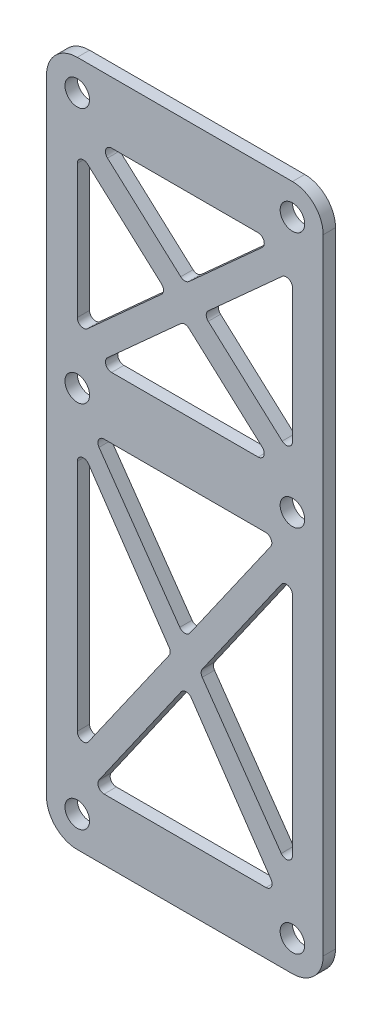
SolidWorks part; units mm, degrees
ref_plane "Спереди" through (0, 0, 0) normal (0, 0, 1) x (1, 0, 0)
ref_plane "Сверху" through (0, 0, 0) normal (0, 1, 0) x (1, 0, 0)
ref_plane "Справа" through (0, 0, 0) normal (1, 0, 0) x (0, 0, -1)
sketch "Эскиз1" plane through (0, 0, 0) normal (0, 0, 1) x (1, 0, 0)
  line L5 (-89.7562, 41.147) -> (-54.7562, 41.147)
  line L7 (-89.7562, -70.453) -> (-54.7562, -70.453)
  line L8 (-49.7562, 36.147) -> (-49.7562, -65.453)
  line L9 (-94.7562, 36.147) -> (-94.7562, -65.453)
  line L10 (-85.3991, -10.453) -> (-59.1148, -10.453)
  line L11 (-54.7562, -17.078) -> (-54.7562, -53.8281)
  line L12 (-59.0635, -60.453) -> (-85.3991, -60.453)
  line L13 (-89.7562, -53.7936) -> (-89.7562, -15.7731)
  line L14 (-84.1719, 31.147) -> (-60.3405, 31.147)
  line L15 (-54.7562, 26.2023) -> (-54.7562, 4.4917)
  line L16 (-60.3405, -0.453) -> (-84.1719, -0.453)
  line L17 (-89.7562, 26.2023) -> (-89.7562, 4.4917)
  line L18 (-88.0861, 26.9445) -> (-76.0628, 16.0892)
  line L19 (-56.4264, 3.7494) -> (-68.4497, 14.6047)
  line L20 (-59.6704, 29.4047) -> (-71.5861, 18.6466)
  line L21 (-84.8421, 1.2892) -> (-72.9264, 12.0474)
  line L22 (-76.0628, 14.6047) -> (-88.0861, 3.7494)
  line L23 (-68.4497, 16.0892) -> (-56.4264, 26.9445)
  line L24 (-72.9264, 18.6466) -> (-84.8421, 29.4047)
  line L25 (-71.5861, 12.0474) -> (-59.6704, 1.2892)
  line L26 (-87.9292, -15.2109) -> (-74.8164, -34.5007)
  line L27 (-56.5757, -54.4013) -> (-69.4297, -36.0262)
  line L28 (-56.5757, -16.5048) -> (-69.4297, -34.8798)
  line L29 (-58.2956, -12.0265) -> (-71.4428, -30.8063)
  line L30 (-74.8242, -35.6364) -> (-87.937, -54.3671)
  line L31 (-72.8621, -39.7866) -> (-86.2185, -58.8798)
  line L32 (-73.0814, -30.806) -> (-86.2185, -12.0262)
  line L33 (-71.2157, -39.7976) -> (-58.2365, -58.8908)
  circle A1 centre (-54.7562, -65.453) radius 2
  circle A2 centre (-54.7562, -5.453) radius 2
  circle A3 centre (-54.7562, 36.147) radius 2
  circle A5 centre (-89.7562, 36.147) radius 2
  circle A6 centre (-89.7562, -5.453) radius 2
  circle A7 centre (-89.7562, -65.453) radius 2
  arc A32 (-94.7562, -65.453) -> (-89.7562, -70.453) centre (-89.7562, -65.453) ccw
  arc A33 (-49.7562, -65.453) -> (-54.7562, -70.453) centre (-54.7562, -65.453) cw
  arc A34 (-54.7562, 41.147) -> (-49.7562, 36.147) centre (-54.7562, 36.147) cw
  arc A35 (-94.7562, 36.147) -> (-89.7562, 41.147) centre (-89.7562, 36.147) cw
  arc A36 (-84.1719, 31.147) -> (-84.8421, 29.4047) centre (-84.1719, 30.147) ccw
  arc A37 (-60.3405, 31.147) -> (-59.6704, 29.4047) centre (-60.3405, 30.147) cw
  arc A38 (-60.3405, -0.453) -> (-59.6704, 1.2892) centre (-60.3405, 0.547) ccw
  arc A39 (-72.9264, 18.6466) -> (-71.5861, 18.6466) centre (-72.2562, 19.3888) ccw
  arc A40 (-68.4497, 14.6047) -> (-68.4497, 16.0892) centre (-67.7795, 15.347) cw
  arc A41 (-54.7562, 26.2023) -> (-56.4264, 26.9445) centre (-55.7562, 26.2023) ccw
  arc A42 (-56.4264, 3.7494) -> (-54.7562, 4.4917) centre (-55.7562, 4.4917) ccw
  arc A43 (-71.5861, 12.0474) -> (-72.9264, 12.0474) centre (-72.2562, 11.3051) ccw
  arc A44 (-76.0628, 16.0892) -> (-76.0628, 14.6047) centre (-76.7329, 15.347) cw
  arc A45 (-89.7562, 4.4917) -> (-88.0861, 3.7494) centre (-88.7562, 4.4917) ccw
  arc A46 (-88.0861, 26.9445) -> (-89.7562, 26.2023) centre (-88.7562, 26.2023) ccw
  arc A47 (-84.1719, -0.453) -> (-84.8421, 1.2892) centre (-84.1719, 0.547) cw
  arc A48 (-86.2185, -12.0262) -> (-85.3991, -10.453) centre (-85.3991, -11.453) cw
  arc A49 (-71.4428, -30.8063) -> (-73.0814, -30.806) centre (-72.262, -30.2328) cw
  arc A50 (-58.2956, -12.0265) -> (-59.1148, -10.453) centre (-59.1148, -11.453) ccw
  arc A51 (-71.2157, -39.7976) -> (-72.8621, -39.7866) centre (-72.0427, -40.3598) ccw
  arc A52 (-85.3991, -60.453) -> (-86.2185, -58.8798) centre (-85.3991, -59.453) cw
  arc A53 (-59.0635, -60.453) -> (-58.2365, -58.8908) centre (-59.0635, -59.453) ccw
  arc A54 (-69.4297, -34.8798) -> (-69.4297, -36.0262) centre (-68.6103, -35.453) ccw
  arc A55 (-56.5757, -16.5048) -> (-54.7562, -17.078) centre (-55.7562, -17.078) cw
  arc A56 (-54.7562, -53.8281) -> (-56.5757, -54.4013) centre (-55.7562, -53.8281) cw
  arc A57 (-74.8164, -34.5007) -> (-74.8242, -35.6364) centre (-75.6434, -35.0629) cw
  arc A58 (-89.7562, -15.7731) -> (-87.9292, -15.2109) centre (-88.7562, -15.7731) cw
  arc A59 (-87.937, -54.3671) -> (-89.7562, -53.7936) centre (-88.7562, -53.7936) cw
  point P56 (-72.2562, 18.0415)
  point P65 (-72.2562, 12.6524)
  point P78 (-72.2623, -31.9769)
  point P83 (-72.0309, -38.5984)
  dimension "D1" = 41.6
  dimension "D6" = 5
  dimension "D7" = 5
  dimension "D8" = 5
  dimension "D9" = 5
  dimension "D10" = 1
  dimension "D11" = 1
  dimension "D12" = 1
  dimension "D13" = 1
  dimension "D14" = 1
  dimension "D15" = 1
  dimension "D16" = 1
  dimension "D17" = 1
  dimension "D18" = 1
  dimension "D19" = 1
  dimension "D20" = 1
  dimension "D21" = 1
  dimension "D22" = 1
  dimension "D23" = 1
  dimension "D24" = 1
  dimension "D25" = 1
  dimension "D26" = 1
  dimension "D27" = 1
  dimension "D28" = 1
  dimension "D29" = 1
  dimension "D30" = 1
  dimension "D31" = 1
  dimension "D32" = 1
  dimension "D33" = 1
  dimension "D2" = 101.6
  dimension "D3" = 5
  dimension "D4" = 5
  dimension "D5" = 5
extrude "Бобышка-Вытянуть1" add sketch "Эскиз1" along normal blind 2
